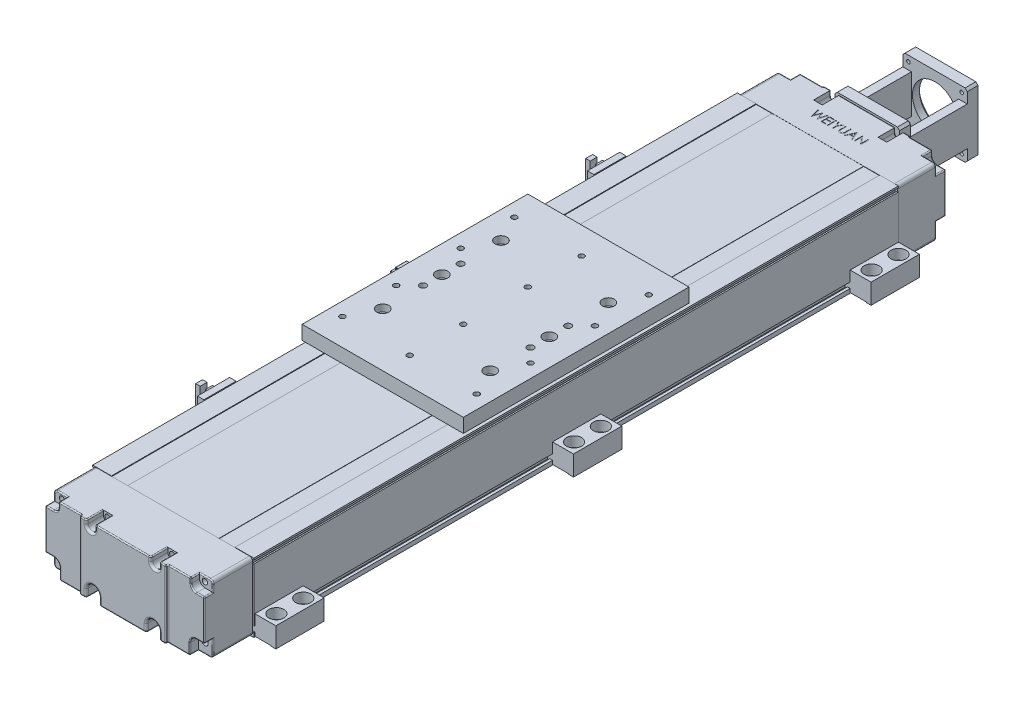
SolidWorks part; units mm, degrees
other "<EE-SX672672P>-<凸台-拉伸3>"
other "<EE-SX672672P>-<凸台-拉伸3>"
other "<EE-SX672672P>-<凸台-拉伸3>"
other "<零件1>-<Ø3.5 (3.5) 直径孔1>"
other "<MSY150B-200W私服电机座>-<倒角1>" parameters "D16"=10, "D17"=10, "D18"=1, "D19"=1, "D20"=1, "D21"=1, "D22"=1, "D23"=1, "D24"=1, "D25"=1
ref_plane "前视基准面" through (0, 0, 0) normal (0, 0, 1) x (1, 0, 0)
ref_plane "上视基准面" through (0, 0, 0) normal (0, 1, 0) x (1, 0, 0)
ref_plane "右视基准面" through (0, 0, 0) normal (1, 0, 0) x (0, 0, -1)
ref_plane "基准面1" through (0, 0, 0) normal (0, 0, 1) x (1, 0, 0)
sketch "草图1" plane through (0, 0, 0) normal (0, 0, 1) x (1, 0, 0)
  line L0 (-70, 10) -> (70, 10)
  line L3 (-70, 10) -> (-70, 20)
  line L4 (-70, 20) -> (-59.8284, 20)
  line L5 (-59.8284, 20) -> (-57.5, 22.3284)
  line L6 (-57.5, 25.5) -> (-57.5, 28)
  line L7 (-57.5, 28) -> (-75, 28)
  line L12 (75, -36) -> (-75, -36)
  line L13 (-75, -36) -> (-75, 28)
  line L14 (-57.5, 23) -> (-60.5, 23)
  line L15 (-60.5, 23) -> (-60.5, 25.5)
  line L16 (-60.5, 25.5) -> (-57.5, 25.5)
  line L17 (-57.5, 23) -> (-57.5, 22.3284)
  line L24 (70, 10) -> (70, 20)
  line L25 (70, 20) -> (59.8284, 20)
  line L26 (59.8284, 20) -> (57.5, 22.3284)
  line L27 (57.5, 23) -> (57.5, 22.3284)
  line L28 (57.5, 23) -> (60.5, 23)
  line L29 (60.5, 23) -> (60.5, 25.5)
  line L30 (60.5, 25.5) -> (57.5, 25.5)
  line L31 (57.5, 25.5) -> (57.5, 28)
  line L32 (57.5, 28) -> (75, 28)
  line L33 (75, -36) -> (75, 28)
  line L36 (0, 31.2) -> (0, -39.2) construction
  dimension "D1" = 115
  dimension "D2" = 3
  dimension "D3" = 2.5
  dimension "D4" = 0.6716
  dimension "D5" = 135
  dimension "D6" = 135
  dimension "D7" = 8
  dimension "D8" = 10
  dimension "D18" = 150
  dimension "D19" = 64
extrude "拉伸1" add sketch "草图1" along normal blind 600
fillet "圆角1" radius 2 1 edges at (-70, 10, 300)
ref_plane "基准面2" through (0, 0, 0) normal (0, 0, 1) x (1, 0, 0)
sketch "草图2" plane through (0, 0, 0) normal (0, 0, 1) x (1, 0, 0)
  line L0 (-75, 26.4) -> (-71.8, 26.4)
  line L1 (-71.8, 26.4) -> (-71.8, 21.6)
  line L2 (-71.8, 21.6) -> (-73.7, 21.6)
  line L3 (-73.7, 21.6) -> (-73.7, 23.2)
  line L4 (-73.7, 23.2) -> (-75, 23.2)
  line L5 (-75, 23.2) -> (-75, 26.4)
  line L6 (-75, -26.9) -> (-72.5, -26.9)
  line L7 (-72.5, -26.9) -> (-72.5, -25.4)
  line L8 (-72.5, -25.4) -> (-70.2, -25.4)
  line L9 (-70.2, -25.4) -> (-70.2, -33.6)
  line L10 (-70.2, -33.6) -> (-72.5, -33.6)
  line L11 (-72.5, -33.6) -> (-72.5, -32.1)
  line L12 (-72.5, -32.1) -> (-75, -32.1)
  line L13 (-75, -32.1) -> (-75, -26.9)
  line L14 (75, -32.1) -> (75, -26.9)
  line L15 (72.5, -32.1) -> (75, -32.1)
  line L16 (72.5, -33.6) -> (72.5, -32.1)
  line L17 (70.2, -33.6) -> (72.5, -33.6)
  line L18 (70.2, -25.4) -> (70.2, -33.6)
  line L19 (72.5, -25.4) -> (70.2, -25.4)
  line L20 (72.5, -26.9) -> (72.5, -25.4)
  line L21 (75, -26.9) -> (72.5, -26.9)
  line L22 (75, 23.2) -> (75, 26.4)
  line L23 (73.7, 23.2) -> (75, 23.2)
  line L24 (73.7, 21.6) -> (73.7, 23.2)
  line L25 (71.8, 21.6) -> (73.7, 21.6)
  line L26 (71.8, 26.4) -> (71.8, 21.6)
  line L27 (75, 26.4) -> (71.8, 26.4)
  line L28 (0, 28.35) -> (0, -36.55) construction
  line L29 (-57.5, 28) -> (-75, 28) construction
  line L30 (-75, -36) -> (75, -36) construction
  point P14 (0, 21.6)
  dimension "D2" = 3.2
  dimension "D3" = 1.6
  dimension "D4" = 3.2
  dimension "D5" = 1.3
  dimension "D6" = 1.6
  dimension "D7" = 1.9
  dimension "D8" = 143.6
  dimension "D9" = 5.2
  dimension "D10" = 3.9
  dimension "D11" = 2.5
  dimension "D12" = 1.5
  dimension "D13" = 2.3
  dimension "D14" = 8.2
  dimension "D15" = 2.3
  dimension "D16" = 2.5
  dimension "D17" = 1.5
  dimension "D18" = 140.4
  dimension "D19" = 150
extrude "拉伸2" cut sketch "草图2" along normal through all
ref_plane "基准面3" through (0, 0, 0) normal (0, 0, 1) x (1, 0, 0)
sketch "草图3" plane through (0, 0, 0) normal (0, 0, 1) x (1, 0, 0)
  line L0 (-38.5389, -30) -> (-61.5389, -30)
  line L1 (-61.5389, -30) -> (-61.5389, -33)
  line L2 (-61.5389, -33) -> (-56.0389, -33)
  line L3 (-38.5389, -33) -> (-38.5389, -30)
  line L4 (38.5389, -33) -> (38.5389, -30)
  line L5 (61.5389, -33) -> (56.0389, -33)
  line L6 (61.5389, -30) -> (61.5389, -33)
  line L7 (38.5389, -30) -> (61.5389, -30)
  line L8 (-18.5, -35.5) -> (18.5, -35.5)
  line L10 (20.5687, -48.09) -> (-20.5687, -48.09)
  line L12 (0, 0) -> (0, -47.9445) construction
  line L13 (-75, -36) -> (75, -36) construction
  line L15 (-75, -36) -> (75, -36) construction
  line L16 (-44.0389, -33) -> (-38.5389, -33)
  line L17 (44.0389, -33) -> (38.5389, -33)
  line L18 (-56.0389, -33) -> (-56.0389, -38.0205)
  line L19 (-56.0389, -38.0205) -> (-44.0389, -38.0205)
  line L20 (-44.0389, -33) -> (-44.0389, -38.0205)
  line L21 (-18.5, -35.5) -> (-20.5687, -37.5687)
  line L22 (44.0389, -33) -> (44.0389, -40.3696)
  line L23 (44.0389, -40.3696) -> (56.0389, -40.3696)
  line L24 (56.0389, -33) -> (56.0389, -40.3696)
  line L25 (18.5, -35.5) -> (20.5687, -37.5687)
  line L26 (-20.5687, -37.5687) -> (-20.5687, -48.09)
  line L27 (20.5687, -37.5687) -> (20.5687, -48.09)
  dimension "D1" = 3
  dimension "D2" = 77.0777
  dimension "D3" = 23
  dimension "D4" = 3
  dimension "D5" = 37
  dimension "D6" = 0.5
  dimension "D8" = 12
  dimension "D9" = 5.5
  dimension "D10" = 5.5
extrude "拉伸3" cut sketch "草图3" along normal through all
sketch "草图6" plane through (0, 0, 600) normal (0, 0, 1) x (1, 0, 0)
  line L0 (0, 28.5875) -> (0, -33.8375) construction
  line L1 (-75, -36) -> (-56.0389, -36) construction
  line L2 (-57.5, 28) -> (-75, 28) construction
  circle A0 centre (66.5, 23.25) radius 2.5
  circle A1 centre (66.5, -25.25) radius 3
  circle A2 centre (28, -28.25) radius 3
  circle A3 centre (-28, -28.25) radius 3
  circle A4 centre (-66.5, -25.25) radius 3
  circle A5 centre (-66.5, 23.25) radius 2.5
  dimension "D1" = 5
  dimension "D2" = 6
  dimension "D3" = 6
  dimension "D4" = 133
  dimension "D5" = 133
  dimension "D6" = 56
  dimension "D7" = 7.75
  dimension "D8" = 48.5
  dimension "D9" = 4.75
extrude "拉伸6" cut sketch "草图6" against normal blind 20
sketch "草图10" plane through (0, -35.5, 0) normal (0, -1, 0) x (1, 0, 0)
  line L0 (0, 0) -> (0, 600) construction
  line L2 (18.5, 600) -> (-18.5, 600) construction
  point P5 (0, 300)
ref_plane "基准面4" through (0, 0, 300) normal (0, 0, 1) x (1, 0, 0)
mirror "镜向1" about plane through (0, 0, 300) normal (0, 0, 1) of "拉伸6"
sketch "草图12" plane through (0, 0, 0) normal (0, 0, -1) x (-1, 0, 0)
  line L0 (0, 0) -> (0, 36.8136) construction
  line L3 (-74, 27.75) -> (74, 27.75)
  line L4 (74, 27.75) -> (74, -35.25)
  line L5 (74, -35.25) -> (-74, -35.25)
  line L6 (-74, 27.75) -> (-74, -35.25)
  circle A0 centre (-66.5, 23.25) radius 2.5
  circle A1 centre (-66.5, -25.25) radius 3
  circle A2 centre (-28, -28.25) radius 3
  circle A3 centre (28, -28.25) radius 3
  circle A4 centre (66.5, -25.25) radius 3
  circle A5 centre (66.5, 23.25) radius 2.5
  circle A6 centre (-66.5, 23.25) radius 2.5
  circle A7 centre (-30, 23.75) radius 2.5
  circle A8 centre (30, 23.75) radius 2.5
  point P24 (0, -35.25)
  point P25 (0, 27.75)
  dimension "D1" = 5
  dimension "D2" = 6
  dimension "D3" = 6
  dimension "D7" = 5
  dimension "D4" = 4.5
  dimension "D5" = 148
  dimension "D6" = 63
  dimension "D8" = 60
  dimension "D9" = 59
extrude "拉伸9" add sketch "草图12" along normal blind 46 contours L3 L4 L5 L6 | A0 | A1 | A2 | A3 | A4 | A5 | A7 | A8
sketch "草图13" plane through (0, 0, -46) normal (0, 0, -1) x (-1, 0, 0)
  line L0 (0, 27.75) -> (0, -35.25) construction
  line L1 (-74, 27.75) -> (74, 27.75) construction
  line L2 (74, -35.25) -> (-74, -35.25) construction
  line L3 (40, 27.75) -> (40, -35.25)
  line L4 (-74, 27.75) -> (-40, 27.75)
  line L5 (-74, 27.75) -> (-74, -35.25)
  line L6 (-74, -35.25) -> (-40, -35.25)
  line L7 (-40, 27.75) -> (-40, -35.25)
  line L8 (74, -35.25) -> (40, -35.25)
  line L9 (74, 27.75) -> (74, -35.25)
  line L10 (74, 27.75) -> (40, 27.75)
  dimension "D1" = 80
extrude "拉伸10" cut sketch "草图13" against normal blind 1
sketch "草图14" plane through (0, 0, -46) normal (0, 0, -1) x (-1, 0, 0)
  line L0 (0, 27.75) -> (0, -35.25) construction
  line L1 (-40, 27.75) -> (40, 27.75) construction
  line L2 (40, -35.25) -> (-40, -35.25) construction
  line L3 (-66.5, 18.25) -> (-74, 18.25)
  line L4 (-74, 27.75) -> (-74, -35.25) construction
  line L5 (-61.5, 23.25) -> (-61.5, 27.75)
  line L6 (-40, 27.75) -> (-74, 27.75) construction
  line L7 (-61.5, 27.75) -> (-74, 27.75)
  line L8 (-74, 27.75) -> (-74, 18.25)
  line L9 (-66.5, -19.25) -> (-74, -19.25)
  line L10 (-60.5, -25.25) -> (-60.5, -35.25)
  line L11 (-74, -35.25) -> (-40, -35.25) construction
  line L12 (-74, -19.25) -> (-74, -35.25)
  line L13 (-74, -35.25) -> (-60.5, -35.25)
  line L14 (74, -35.25) -> (60.5, -35.25)
  line L15 (74, -19.25) -> (74, -35.25)
  line L16 (60.5, -25.25) -> (60.5, -35.25)
  line L17 (66.5, -19.25) -> (74, -19.25)
  line L18 (74, 27.75) -> (74, 18.25)
  line L19 (61.5, 27.75) -> (74, 27.75)
  line L20 (61.5, 23.25) -> (61.5, 27.75)
  line L21 (66.5, 18.25) -> (74, 18.25)
  arc A0 (-66.5, 18.25) -> (-61.5, 23.25) centre (-66.5, 23.25) ccw
  arc A1 (-60.5, -25.25) -> (-66.5, -19.25) centre (-66.5, -25.25) ccw
  arc A2 (60.5, -25.25) -> (66.5, -19.25) centre (66.5, -25.25) cw
  arc A3 (66.5, 18.25) -> (61.5, 23.25) centre (66.5, 23.25) cw
  dimension "D1" = 10
  dimension "D2" = 12
extrude "拉伸11" cut sketch "草图14" against normal blind 10
sketch "草图15" plane through (0, 0, -46) normal (0, 0, -1) x (-1, 0, 0)
  line L0 (0, 27.75) -> (0, -35.25) construction
  line L1 (-40, 27.75) -> (40, 27.75) construction
  line L2 (40, -35.25) -> (-40, -35.25) construction
  line L3 (-34, -28.25) -> (-34, -35.25)
  line L5 (-22, -28.25) -> (-22, -35.25)
  line L6 (-34, -35.25) -> (-22, -35.25)
  line L7 (-34, 23.75) -> (-34, 27.75)
  line L8 (-26, 23.75) -> (-26, 27.75)
  line L9 (-34, 27.75) -> (-26, 27.75)
  line L10 (34, 27.75) -> (26, 27.75)
  line L11 (26, 23.75) -> (26, 27.75)
  line L12 (34, 23.75) -> (34, 27.75)
  line L13 (34, -35.25) -> (22, -35.25)
  line L14 (22, -28.25) -> (22, -35.25)
  line L15 (34, -28.25) -> (34, -35.25)
  arc A0 (-22, -28.25) -> (-34, -28.25) centre (-28, -28.25) ccw
  arc A1 (-34, 23.75) -> (-26, 23.75) centre (-30, 23.75) ccw
  arc A2 (34, 23.75) -> (26, 23.75) centre (30, 23.75) cw
  arc A3 (22, -28.25) -> (34, -28.25) centre (28, -28.25) cw
  dimension "D1" = 12
  dimension "D2" = 8
extrude "拉伸12" cut sketch "草图15" against normal blind 16
mirror "镜向2" about plane through (0, 0, 300) normal (0, 0, 1) of "拉伸9"
sketch "草图69" plane through (0, 0, 646) normal (0, 0, 1) x (1, 0, 0)
  line L1 (-74, 27.75) -> (74, 27.75)
  line L2 (-74, 27.75) -> (-74, -35.25)
  line L3 (-74, -35.25) -> (74, -35.25)
  line L4 (74, 27.75) -> (74, -35.25)
  circle A0 centre (-66.5, 23.25) radius 2.5
  circle A1 centre (-30, 23.75) radius 2.5
  circle A2 centre (30, 23.75) radius 2.5
  circle A3 centre (66.5, 23.25) radius 2.5
  circle A4 centre (66.5, -25.25) radius 3
  circle A5 centre (28, -28.25) radius 3
  circle A6 centre (-28, -28.25) radius 3
  circle A7 centre (-66.5, -25.25) radius 3
extrude "凸台-拉伸4" add sketch "草图69" along normal blind 1
ref_plane "基准面14" through (0, 0, 300.5) normal (0, 0, -1) x (-1, 0, 0)
mirror "镜向4" about plane through (0, 0, 300.5) normal (0, 0, -1) of "拉伸11", "拉伸12"
sketch "草图28" plane through (0, 0, 0) normal (0, 0, 1) x (1, 0, 0)
  line L0 (-30, 23.75) -> (30, 23.75) construction
  line L1 (0, 23.75) -> (0, 45.4181) construction
  line L2 (42.5, 27.65) -> (-42.5, 27.65)
  line L3 (-42.5, 27.65) -> (-42.5, 25.15)
  line L4 (-42.5, 25.15) -> (-39.5, 25.15)
  line L5 (-39.5, 25.15) -> (-39.5, 22.65)
  line L6 (-39.5, 22.65) -> (-42.5, 22.65)
  line L7 (-42.5, 22.65) -> (-42.5, 20.25)
  line L8 (-42.5, 20.25) -> (42.5, 20.25)
  line L9 (42.5, 22.65) -> (42.5, 20.25)
  line L10 (39.5, 22.65) -> (42.5, 22.65)
  line L11 (39.5, 25.15) -> (39.5, 22.65)
  line L12 (42.5, 25.15) -> (39.5, 25.15)
  line L13 (42.5, 27.65) -> (42.5, 25.15)
  circle A0 centre (-30, 23.75) radius 2.5
  circle A1 centre (30, 23.75) radius 2.5
  point P18 (0, 20.25)
  point P23 (0, 27.65)
  dimension "D1" = 5
  dimension "D2" = 7.4
  dimension "D3" = 2.5
  dimension "D4" = 3
  dimension "D5" = 2.5
  dimension "D6" = 3.9
  dimension "D7" = 85
extrude "拉伸20" add sketch "草图28" along normal up to next
sketch "草图29" plane through (0, 0, 300) normal (0, 0, 1) x (1, 0, 0)
  line L0 (0, 27.75) -> (0, -35.25) construction
  line L3 (0, -3.25) -> (43.1391, -3.25) construction
  line L5 (0, 11.75) -> (-74, 11.75) construction
  line L6 (68, 11.75) -> (68, 17.75)
  line L7 (-68, 11.75) -> (68, 11.75)
  line L8 (-68, 11.75) -> (-68, 17.75)
  line L9 (-68, 17.75) -> (-57, 17.75)
  line L10 (-56, 18.75) -> (-56, 31)
  line L11 (-56, 31) -> (-44, 31)
  line L12 (-44, 31) -> (-44, 21.5)
  line L13 (-43, 20.5) -> (-14.355, 20.5)
  line L14 (-13.355, 21.5) -> (-13.355, 21.75)
  line L15 (-13.355, 21.75) -> (13.355, 21.75)
  line L16 (13.355, 21.5) -> (13.355, 21.75)
  line L17 (43, 20.5) -> (14.355, 20.5)
  line L18 (44, 31) -> (44, 21.5)
  line L19 (56, 31) -> (44, 31)
  line L20 (56, 18.75) -> (56, 31)
  line L21 (68, 17.75) -> (57, 17.75)
  line L23 (19, -36) -> (44.0389, -36) construction
  line L27 (-14.355, 20.5) -> (-13.355, 21.5)
  line L28 (14.355, 20.5) -> (13.355, 21.5)
  line L29 (-57, 17.75) -> (-56, 18.75)
  line L30 (-44, 21.5) -> (-43, 20.5)
  line L31 (44, 21.5) -> (43, 20.5)
  line L32 (57, 17.75) -> (56, 18.75)
  point P17 (-56, 17.75)
  point P20 (-44, 20.5)
  point P21 (-13.355, 20.5)
  point P23 (13.355, 20.5)
  point P24 (0, 21.75)
  point P25 (44, 20.5)
  point P28 (56, 17.75)
  point P33 (0, -24.75)
  dimension "D3" = 15
  dimension "D4" = 25
  dimension "D5" = 6
  dimension "D6" = 136
  dimension "D7" = 32.75
  dimension "D9" = 13.25
  dimension "D10" = 10.5
  dimension "D11" = 12
  dimension "D12" = 12
  dimension "D13" = 26.71
extrude "拉伸21" add sketch "草图29" along normal mid plane 100
sketch "草图30" plane through (0, 31, 0) normal (0, 1, 0) x (1, 0, 0)
  line L0 (-56, -300) -> (56, -300) construction
  line L1 (-56, -350) -> (-56, -250) construction
  line L2 (56, -350) -> (56, -250) construction
  line L3 (0, -300) -> (0, -76.3473) construction
  line L4 (-44, -350) -> (-44, -250) construction
  line L5 (-56, -250) -> (-44, -250)
  line L6 (-56, -250) -> (-56, -275)
  line L7 (-56, -275) -> (-44, -275)
  line L8 (-44, -250) -> (-44, -275)
  line L9 (-44, -350) -> (-44, -325)
  line L10 (-56, -325) -> (-44, -325)
  line L11 (-56, -350) -> (-56, -325)
  line L12 (-56, -350) -> (-44, -350)
  line L13 (56, -350) -> (44, -350)
  line L14 (56, -350) -> (56, -325)
  line L15 (56, -325) -> (44, -325)
  line L16 (44, -350) -> (44, -325)
  line L17 (44, -250) -> (44, -275)
  line L18 (56, -275) -> (44, -275)
  line L19 (56, -250) -> (56, -275)
  line L20 (56, -250) -> (44, -250)
  dimension "D1" = 50
extrude "拉伸22" cut sketch "草图30" against normal blind 5.5
sketch "草图31" plane through (0, 31, 0) normal (0, 1, 0) x (1, 0, 0)
  line L0 (-50, -275) -> (-50, -325) construction
  line L1 (-56, -275) -> (-44, -275) construction
  line L2 (-44, -325) -> (-56, -325) construction
  line L3 (50, -275) -> (50, -325) construction
  line L4 (44, -275) -> (56, -275) construction
  line L5 (56, -325) -> (44, -325) construction
  line L6 (-50, -300) -> (50, -300) construction
  line L7 (-50, -282) -> (50, -282) construction
  line L8 (-50, -318) -> (50, -318) construction
  circle A0 centre (-50, -300) radius 3
  circle A1 centre (50, -300) radius 3
  dimension "D2" = 6
  dimension "D3" = 6
  dimension "D1" = 36
hole_wizard "M6 螺纹孔1" positions "3D草图4" profile "草图32" tap size "M6" standard "GB"
sketch3d "3D草图4"
  point P0 (-50, 31, 282)
  point P3 (-50, 31, 318)
  point P6 (50, 31, 318)
  point P9 (50, 31, 282)
sketch "草图32" plane through (-50, 31, 282) normal (1, 0, 0) x (0, 0, 1)
  line L0 (0, 0) -> (0, 18.5022)
  line L1 (0, 18.5022) -> (2.5, 17)
  line L2 (2.5, 17) -> (2.5, 0)
  line L5 (2.5, 0) -> (0, 0)
  line L10 (0, 18.5022) -> (-2.5, 17) construction
  line L11 (0, -6.35) -> (0, 107.95) construction
  dimension "螺纹孔钻头直径" = 5
  dimension "螺纹孔钻头深度" = 17
  dimension "导头角度" = 118
sketch "草图33" plane through (0, 25.5, 0) normal (0, 1, 0) x (1, 0, 0)
  line L0 (0, 0) -> (0, -600) construction
  line L1 (57.5, -600) -> (-57.5, -600) construction
  line L3 (-57.4, -274.9) -> (-42.6, -274.9)
  line L4 (-57.4, -274.9) -> (-57.4, 0)
  line L5 (-57.4, 0) -> (-42.6, 0)
  line L6 (-42.6, -274.9) -> (-42.6, 0)
  line L7 (-57.5, -600) -> (-57.5, 0) construction
  line L9 (-42.5, -600) -> (-42.5, 0) construction
  line L10 (-56, -275) -> (-44, -275) construction
  line L11 (42.6, -274.9) -> (42.6, 0)
  line L12 (57.4, 0) -> (42.6, 0)
  line L13 (57.4, -274.9) -> (57.4, 0)
  line L14 (57.4, -274.9) -> (42.6, -274.9)
  line L15 (0, -300) -> (22.0954, -300) construction
  line L16 (57.4, -325.1) -> (42.6, -325.1)
  line L17 (57.4, -325.1) -> (57.4, -600)
  line L18 (57.4, -600) -> (42.6, -600)
  line L19 (42.6, -325.1) -> (42.6, -600)
  line L20 (-42.6, -325.1) -> (-42.6, -600)
  line L21 (-57.4, -600) -> (-42.6, -600)
  line L22 (-57.4, -325.1) -> (-57.4, -600)
  line L23 (-57.4, -325.1) -> (-42.6, -325.1)
  dimension "D1" = 0.1
  dimension "D2" = 0.1
  dimension "D3" = 0.1
extrude "拉伸23" add sketch "草图33" along normal blind 2
sketch "草图34" plane through (0, 31, 0) normal (0, 1, 0) x (1, 0, 0)
  line L0 (0, 0) -> (0, -600) construction
  line L1 (-42.5, -600) -> (42.5, -600) construction
  line L2 (-75, -300) -> (75, -300) construction
  line L3 (-75, -600) -> (-75, 0) construction
  line L4 (75, -600) -> (75, 0) construction
  line L5 (-75, -405) -> (-75, -195)
  line L6 (75, -405) -> (75, -195)
  line L8 (-75, -195) -> (75, -195)
  line L9 (-75, -405) -> (75, -405)
  line L10 (-50, -245) -> (-50, -355) construction
  line L11 (50, -245) -> (50, -355) construction
  circle A4 centre (-50, -245) radius 2.75
  circle A5 centre (50, -245) radius 2.75
  circle A6 centre (-50, -355) radius 2.75
  circle A7 centre (50, -355) radius 2.75
  circle A8 centre (-50, -300) radius 2.75
  circle A9 centre (50, -300) radius 2.75
  dimension "D2" = 110
  dimension "D5" = 5.5
  dimension "D1" = 210
  dimension "D4" = 100
extrude "拉伸24" add sketch "草图34" along normal blind 13 separate body
sketch "草图35" plane through (0, 44, 0) normal (0, 1, 0) x (1, 0, 0)
  line L0 (0, -195) -> (0, -405) construction
  line L1 (75, -195) -> (-75, -195) construction
  line L2 (-75, -405) -> (75, -405) construction
  line L3 (-75, -300) -> (75, -300) construction
  line L4 (-75, -195) -> (-75, -405) construction
  line L5 (75, -405) -> (75, -195) construction
  line L6 (25, -195) -> (25, -405) construction
  line L7 (-75, -260) -> (75, -260) construction
  line L8 (-75, -340) -> (75, -340) construction
  line L9 (-25, -195) -> (-25, -405) construction
  line L10 (-62.5, -195) -> (-62.5, -405) construction
  line L11 (62.5, -195) -> (62.5, -405) construction
  dimension "D1" = 50
  dimension "D2" = 80
  dimension "D3" = 125
sketch "草图39" plane through (0, 0, 0) normal (0, 0, 1) x (1, 0, 0)
  line L0 (-74, -26.9) -> (-75, -26.9) construction
  line L11 (-70.25, -27.1) -> (-70.25, -35.48)
  line L13 (-94.5, -36) -> (-94.5, -17.3046)
  line L14 (-94.5, -17.3046) -> (-75, -17.3046)
  line L15 (-70.25, -35.48) -> (-75, -35.48)
  line L17 (-70.25, -27.1) -> (-75, -27.1)
  line L18 (-75, -17.3046) -> (-75, -27.1)
  line L19 (-75, 23.2) -> (-75, -26.9) construction
  line L20 (-75, -32.1) -> (-74, -32.1) construction
  line L21 (-75, -36) -> (-56.0389, -36) construction
  line L22 (-75, -35.5) -> (-75, -35.48)
  line L23 (-75, -32.1) -> (-75, -36) construction
  line L25 (-75, -35.5) -> (-90, -35.5)
  line L26 (-90, -35.5) -> (-90, -36)
  line L27 (-90, -36) -> (-94.5, -36)
  point P0 (-74.5, -26.9)
  point P4 (-74.5, -32.1)
  dimension "D1" = 3.38
  dimension "D2" = 0.2
  dimension "D3" = 0.5
  dimension "D4" = 4.5
  dimension "D5" = 19.5
extrude "拉伸25" add sketch "草图39" along normal blind 45
sketch "草图41" plane through (0, -17.3046, 0) normal (0, 1, 0) x (1, 0, 0)
  line L0 (-94.5, -22.5) -> (94.5, -22.5) construction
  line L1 (-94.5, -45) -> (-94.5, 0) construction
  line L3 (0, 0) -> (0, -22.5) construction
  circle A0 centre (-85, -10) radius 4.25
  circle A3 centre (-85, -35) radius 4.25
  dimension "D1" = 8.5
  dimension "D3" = 25
extrude "拉伸26" cut sketch "草图41" against normal through all
sketch "草图42" plane through (0, -17.3046, 0) normal (0, 1, 0) x (1, 0, 0)
  line L0 (0, 0) -> (0, -40.0548) construction
  line L1 (-85, -10) -> (-85, -35) construction
  line L2 (-94.5, -22.5) -> (-75, -22.5) construction
  line L3 (-94.5, -45) -> (-94.5, 0) construction
  line L4 (-75, -45) -> (-75, 0) construction
  circle A0 centre (-85, -10) radius 7
  circle A1 centre (-85, -35) radius 7
  circle A2 centre (85, -35) radius 7
  circle A3 centre (85, -10) radius 7
  dimension "D1" = 14
extrude "拉伸27" cut sketch "草图42" against normal blind 9.5
hole_wizard "M6 螺纹孔2" positions "草图46" profile "草图45" tap size "M6" standard "GB"
sketch "草图46" plane through (0, 44, 0) normal (0, 1, 0) x (-1, 0, 0)
  line L0 (62.5, 195) -> (62.5, 405) construction
  line L2 (0, 195) -> (0, 405) construction
  line L3 (-62.5, 195) -> (-62.5, 405) construction
  line L4 (-75, 300) -> (75, 300) construction
  line L5 (-75, 405) -> (-75, 195) construction
  line L6 (75, 600) -> (75, 0) construction
  point P0 (62.5, 380)
  point P1 (0, 380)
  point P3 (-62.5, 380)
  point P5 (-62.5, 220)
  point P7 (0, 220)
  point P9 (62.5, 220)
  point P27 (62.5, 330)
  point P28 (0, 330)
  point P29 (-62.5, 330)
  point P32 (62.5, 270)
  point P33 (0, 270)
  point P34 (-62.5, 270)
  dimension "D1" = 0
  dimension "D2" = 160
  dimension "D3" = 0
  dimension "D4" = 0
  dimension "D5" = 60
sketch "草图45" plane through (-62.5, 44, 380) normal (1, 0, 0) x (0, 0, 1)
  line L0 (0, 0) -> (0, 12.5022)
  line L1 (0, 12.5022) -> (2.5, 11)
  line L2 (2.5, 11) -> (2.5, 0)
  line L5 (2.5, 0) -> (0, 0)
  line L10 (0, 12.5022) -> (-2.5, 11) construction
  line L11 (0, -6.35) -> (0, 107.95) construction
  dimension "螺纹孔钻头直径" = 5
  dimension "螺纹孔钻头深度" = 11
  dimension "导头角度" = 118
hole_wizard "孔1" positions "草图48" profile "草图49" legacy
sketch "草图48" plane through (0, 44, 0) normal (0, 1, 0) x (-1, 0, 0)
  point P19 (-50, 355)
  point P22 (50, 355)
  point P25 (50, 245)
  point P28 (-50, 245)
  point P38 (50, 300)
  point P41 (-50, 300)
sketch "草图49" plane through (50, 44, 355) normal (1, 0, 0) x (0, 0, 1)
  line L0 (0, 0) -> (0, 6.5)
  line L1 (0, 6.5) -> (5.5, 6.5)
  line L2 (5.5, 6.5) -> (5.5, 0)
  line L3 (5.5, 0) -> (0, 0)
  line L4 (0, 110) -> (0, -10) construction
  dimension "直径" = 11
  dimension "深度" = 6.5
extrude "切除-拉伸1" cut sketch "草图31" against normal blind 10
sketch "草图50" plane through (0, 0, -46) normal (0, 0, -1) x (-1, 0, 0)
  line L0 (75, -36) -> (56.0389, -36) construction
  line L1 (0, 27.75) -> (0, -1) construction
  line L2 (-26, 27.75) -> (26, 27.75) construction
  circle A0 centre (0, -1) radius 25
  dimension "D1" = 35
  dimension "D2" = 50
extrude "凸台-拉伸1" add sketch "草图50" along normal blind 6
sketch "草图51" plane through (0, 0, -52) normal (0, 0, -1) x (-1, 0, 0)
  line L1 (75, -36) -> (56.0389, -36) construction
  circle A0 centre (0, -1) radius 7
  dimension "D1" = 14
  dimension "D2" = 35
extrude "凸台-拉伸2" add sketch "草图51" along normal blind 25
chamfer "倒角1" distance 1 angle 45 2 edges at (-7, -1, -77) (-25, -1, -52)
hole_wizard "M5 螺纹孔1" positions "草图53" profile "草图52" tap size "M5" standard "Gb"
sketch "草图53" plane through (0, 0, -46) normal (0, 0, -1) x (-1, 0, 0)
  line L0 (-25, -1) -> (25, -1) construction
  line L2 (0, 24) -> (0, -26) construction
  circle A0 centre (0, -1) radius 25 construction
  circle A1 centre (0, -1) radius 25 construction
  point P0 (-18, 23)
  point P2 (18, 23)
  point P4 (18, -25)
  point P6 (-18, -25)
  dimension "D1" = 36
  dimension "D2" = 48
sketch "草图52" plane through (18, 23, -46) normal (1, 0, 0) x (0, 1, 0)
  line L0 (0, 0) -> (0, 13.6618)
  line L1 (0, 13.6618) -> (2.1, 12.4)
  line L2 (2.1, 12.4) -> (2.1, 0)
  line L5 (2.1, 0) -> (0, 0)
  line L10 (0, 13.6618) -> (-2.1, 12.4) construction
  line L11 (0, -6.35) -> (0, 107.95) construction
  dimension "螺纹孔钻头直径" = 4.2
  dimension "螺纹孔钻头深度" = 12.4
  dimension "导头角度" = 118
sketch "草图54" plane through (0, 27.75, 0) normal (0, 1, 0) x (1, 0, 0)
  text T0 "WEIYUAN" font "Century Gothic" height 8
extrude "切除-拉伸2" cut sketch "草图54" against normal blind 0.2
pattern_linear "阵列(线性)1" count 3 spacing 277 along (0, 0, 1) of "拉伸25", "拉伸27", "拉伸26"
mirror "镜向3" about plane through (0, 0, 0) normal (1, 0, 0) of "阵列(线性)1", "拉伸25", "拉伸26", "拉伸27"
hole_wizard "M3 螺纹孔1" positions "草图56" profile "草图55" tap size "M3" standard "Gb"
sketch "草图56" plane through (-75, 0, 0) normal (-1, 0, 0) x (0, 0, 1)
  line L0 (405, 37.5) -> (291.6398, 37.5) construction
  line L1 (405, 44) -> (405, 31) construction
  line L2 (300, 44) -> (300, 31) construction
  line L3 (195, 44) -> (405, 44) construction
  line L4 (195, 31) -> (405, 31) construction
  point P0 (300, 37.5)
sketch "草图55" plane through (-75, 37.5, 300) normal (0, 1, 0) x (0, 0, 1)
  line L0 (0, 0) -> (0, 8.2511)
  line L1 (0, 8.2511) -> (1.25, 7.5)
  line L2 (1.25, 7.5) -> (1.25, 0)
  line L5 (1.25, 0) -> (0, 0)
  line L10 (0, 8.2511) -> (-1.25, 7.5) construction
  line L11 (0, -6.35) -> (0, 107.95) construction
  dimension "螺纹孔钻头直径" = 2.5
  dimension "螺纹孔钻头深度" = 7.5
  dimension "导头角度" = 118
hole_wizard "Ø6.0 (6) 直径孔1" positions "草图58" profile "草图57" hole size "Ø6.0" standard "Gb"
sketch "草图58" plane through (0, 44, 0) normal (0, 1, 0) x (1, 0, 0)
  line L0 (0, -195) -> (0, -405) construction
  line L1 (75, -195) -> (-75, -195) construction
  line L2 (-75, -405) -> (75, -405) construction
  line L3 (-75, -300) -> (75, -300) construction
  line L4 (-75, -195) -> (-75, -405) construction
  line L5 (75, -405) -> (75, -195) construction
  point P0 (-50, -282.5)
  point P4 (50, -282.5)
  point P21 (-50, -317.5)
  point P23 (50, -317.5)
  dimension "D1" = 100
  dimension "D2" = 35
sketch "草图57" plane through (-50, 44, 282.5) normal (1, 0, 0) x (0, 0, 1)
  line L0 (0, 0) -> (0, 38.8026)
  line L1 (0, 38.8026) -> (3, 37)
  line L2 (3, 37) -> (3, 0)
  line L5 (3, 0) -> (0, 0)
  line L10 (0, 38.8026) -> (-3, 37) construction
  line L11 (0, -6.35) -> (0, 107.95) construction
  dimension "孔直径" = 6
  dimension "孔深度" = 37
  dimension "导头角度" = 118
ref_plane "基准面5" through (0, 0, 300) normal (0, 0, 1) x (1, 0, 0)
sketch "草图59" plane through (0, 0, 300) normal (0, 0, 1) x (1, 0, 0)
  line L15 (0, 27.75) -> (0, -35.25) construction
  line L18 (-75, 7.8901) -> (-75, 13.2401)
  line L19 (-75, 22.9901) -> (-75, 16.1401)
  line L20 (-75, 13.2401) -> (-75.5409, 13.2401)
  line L21 (-75, 16.1401) -> (-75.5409, 16.1401)
  line L22 (-75, 28.8901) -> (-81, 28.8901)
  line L23 (-81, 7.8901) -> (-81, 28.8901)
  line L24 (-71.7, 27.2901) -> (-71.7, 22.0901)
  line L25 (-73.3, 22.9901) -> (-73.3, 22.0901)
  line L26 (-73.3, 27.2901) -> (-73.3, 26.3901)
  line L27 (-75, 28.8901) -> (-75, 26.3901)
  line L28 (-73.3, 26.3901) -> (-75, 26.3901)
  line L29 (-73.3, 22.9901) -> (-75, 22.9901)
  line L30 (-71.7, 22.0901) -> (-73.3, 22.0901)
  line L31 (-71.7, 27.2901) -> (-73.3, 27.2901)
  line L32 (-81, 7.8901) -> (-75, 7.8901)
  arc A1 (-75.5409, 13.2401) -> (-75.5409, 16.1401) centre (-77.06, 14.6901) cw
extrude "凸台-拉伸3" add sketch "草图59" along normal mid plane 30
hole_wizard "M3 螺纹孔2" positions "草图61" profile "草图60" tap size "M3" standard "Gb"
sketch "草图61" plane through (-81, -1.3625, -11.138) normal (1, 0, 0) x (0, 0, -1)
  line L0 (-311.138, 30.2527) -> (-311.138, 7.8901) construction
  line L4 (-326.138, 30.2527) -> (-296.138, 30.2527) construction
  point P0 (-301.638, 25.6527)
  point P2 (-320.638, 25.6527)
  point P4 (-320.638, 12.6527)
  point P6 (-301.638, 12.6527)
  dimension "D1" = 19
  dimension "D2" = 4.6
  dimension "D3" = 13
sketch "草图60" plane through (-81, 24.2901, 290.5) normal (0, 1, 0) x (0, 0, 1)
  line L0 (0, 0) -> (0, 8.2511)
  line L1 (0, 8.2511) -> (1.25, 7.5)
  line L2 (1.25, 7.5) -> (1.25, 0)
  line L5 (1.25, 0) -> (0, 0)
  line L10 (0, 8.2511) -> (-1.25, 7.5) construction
  line L11 (0, -6.35) -> (0, 107.95) construction
  dimension "螺纹孔钻头直径" = 2.5
  dimension "螺纹孔钻头深度" = 7.5
  dimension "导头角度" = 118
inserted part "EE-SX672672P"
move or copy body "实体-移动/复制4" placed by mates yes
pattern_linear "阵列(线性)2" count 2 spacing 181.5 along (0, 0, -1) count 2 spacing 181.5 along (0, 0, 1) of "凸台-拉伸3", "M3 螺纹孔2"
inserted part "EE-SX672672P3"
move or copy body "实体-移动/复制8" placed by mates yes
inserted part "EE-SX672672P4"
move or copy body "实体-移动/复制10" placed by mates yes
inserted part "零件1"
move or copy body "实体-移动/复制12" placed by mates yes
inserted part "MSY150B-200W私服电机座"
move or copy body "实体-移动/复制14" placed by mates yes
sketch "草图74" plane through (0, 0, 647) normal (0, 0, 1) x (1, 0, 0)
  line L1 (-40, 35.25) -> (40, 35.25)
  line L2 (-40, 35.25) -> (-40, -35.25)
  line L3 (-40, -35.25) -> (40, -35.25)
  line L4 (40, 35.25) -> (40, -35.25)
  line L5 (-40, 35.25) -> (40, -35.25) construction
  line L6 (-40, -35.25) -> (40, 35.25) construction
  point P0 (0, 0)
  dimension "D1" = 80
extrude "切除-拉伸4" cut sketch "草图74" against normal blind 2 flip side to cut
fillet "圆角2" radius 2 12 edges at (-34, -31.75, 647) (-22, -31.75, 647) (22, -31.75, 647) (34, -31.75, 647) (34, 25.75, 647) (26, 25.75, 647) (-26, 25.75, 647) (-34, 25.75, 647) (-28, -22.25, 647) (28, -22.25, 647) (30, 19.75, 647) (-30, 19.75, 647)
fillet "圆角3" radius 1 24 edges at (-34, 27.75, 638) (-34.5858, 27.75, 646.4142) (26, 27.75, 638) (25.4142, 27.75, 646.4142) (-26, 27.75, 638) (-25.4142, 27.75, 646.4142) (34, 27.75, 638) (34.5858, 27.75, 646.4142) (34, -35.25, 638) (34.5858, -35.25, 646.4142) (-22, -35.25, 638) (-21.4142, -35.25, 646.4142) (22, -35.25, 638) (21.4142, -35.25, 646.4142) (-34, -35.25, 638) (-34.5858, -35.25, 646.4142) (-40, -3.75, 647) (-38, 27.75, 647) (0, 27.75, 647) (38, 27.75, 647) (40, -3.75, 647) (38, -35.25, 647) (0, -35.25, 647) (-38, -35.25, 647)
fillet "圆角4" radius 1 12 edges at (39.7071, -34.9571, 646.7071) (39.7071, 27.4571, 646.7071) (61.5, 25.5, 645) (62.9645, 19.7145, 645) (70.25, 18.25, 645) (74, -0.5, 645) (70.25, -19.25, 645) (62.2574, -21.0074, 645) (60.5, -30.25, 645) (50.25, -35.25, 645) (40, -3.75, 645) (50.75, 27.75, 645)
fillet "圆角5" radius 1 12 edges at (-39.7071, 27.4571, 646.7071) (-39.7071, -34.9571, 646.7071) (-60.5, -30.25, 645) (-62.2574, -21.0074, 645) (-70.25, -19.25, 645) (-74, -0.5, 645) (-70.25, 18.25, 645) (-62.9645, 19.7145, 645) (-61.5, 25.5, 645) (-50.75, 27.75, 645) (-40, -3.75, 645) (-50.25, -35.25, 645)
fillet "圆角6" radius 1 24 edges at (61.2071, 27.4571, 644.7071) (73.7071, 17.9571, 644.7071) (73.7071, -18.9571, 644.7071) (60.2071, -34.9571, 644.7071) (-60.2071, -34.9571, 644.7071) (-73.7071, -18.9571, 644.7071) (-73.7071, 17.9571, 644.7071) (-61.2071, 27.4571, 644.7071) (61.5, 27.75, 640.5) (74, 18.25, 640.5) (67.75, 27.75, 637) (74, 23, 637) (67.25, -35.25, 637) (74, -27.25, 637) (74, -19.25, 640.5) (60.5, -35.25, 640.5) (-60.5, -35.25, 640.5) (-67.25, -35.25, 637) (-74, -27.25, 637) (-74, -19.25, 640.5) (-74, 18.25, 640.5) (-61.5, 27.75, 640.5) (-74, 23, 637) (-67.75, 27.75, 637)
fillet "圆角7" radius 3 8 edges at (73.7071, 27.4571, 636.7071) (73.7071, -34.9571, 636.7071) (-73.7071, 27.4571, 636.7071) (-73.7071, -34.9571, 636.7071) (-74, -35.25, 618) (-74, 27.75, 618) (74, -35.25, 618) (74, 27.75, 618)
sketch "草图75" plane through (0, -35.25, 0) normal (0, -1, 0) x (1, 0, 0)
  text T0 "MSY150B-HDG" font "Century Gothic" height 4.5
extrude "切除-拉伸5" cut sketch "草图75" against normal blind 0.5
fillet "圆角8" radius 3 4 edges at (-74, -35.25, -18) (-74, 27.75, -18) (74, -35.25, -18) (74, 27.75, -18)
fillet "圆角9" radius 1 40 edges at (62.2574, -21.0074, -45) (70.25, -19.25, -45) (74, -0.5, -45) (70.25, 18.25, -45) (62.9645, 19.7145, -45) (61.5, 25.5, -45) (50.75, 27.75, -45) (40, -3.75, -45) (50.25, -35.25, -45) (60.5, -30.25, -45) (-62.9645, 19.7145, -45) (-70.25, 18.25, -45) (-74, -0.5, -45) (-70.25, -19.25, -45) (-62.2574, -21.0074, -45) (-60.5, -30.25, -45) (-50.25, -35.25, -45) (-40, -3.75, -45) (-50.75, 27.75, -45) (-61.5, 25.5, -45) (60.5, -35.25, -40.5) (65.75, -35.25, -36) (73.1213, -34.3713, -36) (74, -25.75, -36) (74, -19.25, -40.5) (74, 18.25, -40.5) (74, 21.5, -36) (73.1213, 26.8713, -36) (66.25, 27.75, -36) (61.5, 27.75, -40.5) (-60.5, -35.25, -40.5) (-65.75, -35.25, -36) (-73.1213, -34.3713, -36) (-74, -25.75, -36) (-74, -19.25, -40.5) (-74, 18.25, -40.5) (-74, 21.5, -36) (-73.1213, 26.8713, -36) (-66.25, 27.75, -36) (-61.5, 27.75, -40.5)
fillet "圆角10" radius 1 29 edges at (25, -1, -46) (34, 25.75, -46) (30, 19.75, -46) (26, 25.75, -46) (0, 27.75, -46) (-26, 25.75, -46) (-30, 19.75, -46) (-34, 25.75, -46) (-36.5, 27.75, -46) (-39.7071, 27.4571, -46) (-40, -3.75, -46) (-39.7071, -34.9571, -46) (-36.5, -35.25, -46) (-34, -31.75, -46) (-28, -22.25, -46) (-22, -31.75, -46) (0, -35.25, -46) (22, -31.75, -46) (28, -22.25, -46) (34, -31.75, -46) (36.5, -35.25, -46) (39.7071, -34.9571, -46) (40, -3.75, -46) (39.7071, 27.4571, -46) (36.5, 27.75, -46) (15.9, -25, -46) (-20.1, -25, -46) (-20.1, 23, -46) (15.9, 23, -46)
